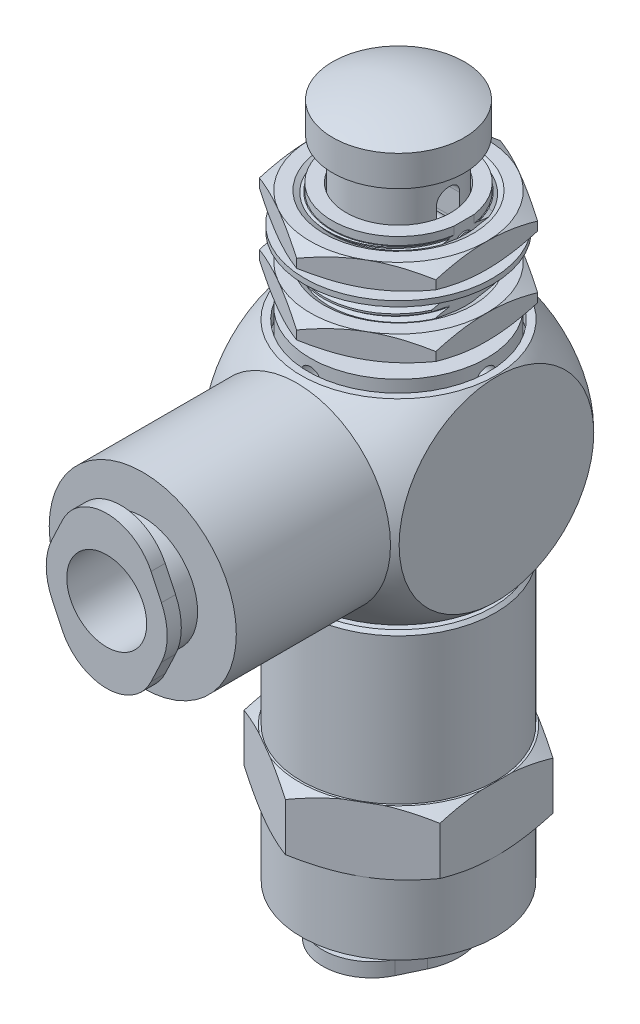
SolidWorks part; units mm, degrees
ref_plane "Front Plane" through (0, 0, 0) normal (0, 0, 1) x (1, 0, 0)
ref_plane "Top Plane" through (0, 0, 0) normal (0, 1, 0) x (1, 0, 0)
ref_plane "Right Plane" through (0, 0, 0) normal (1, 0, 0) x (0, 0, -1)
imported_body "62475K - Body B, 2 Port-1-solid1"
imported_body "62475K - Input B, 0.25 PtC-1-solid1"
imported_body "62475K - Output B, 0.25 PTC-1-solid1"
imported_body "62475K - Pin-2-solid1"
imported_body "62475K - Button-2-solid1"
imported_body "62475K - Nut-2-solid1"
imported_body "62475K - Nut-3-solid1"
imported_body "62475K - Washer-2-solid1"
move or copy body "Body-Move/Copy1" bodies to move or copy 109 108 copy no translate (0, 1.8542, 0)
